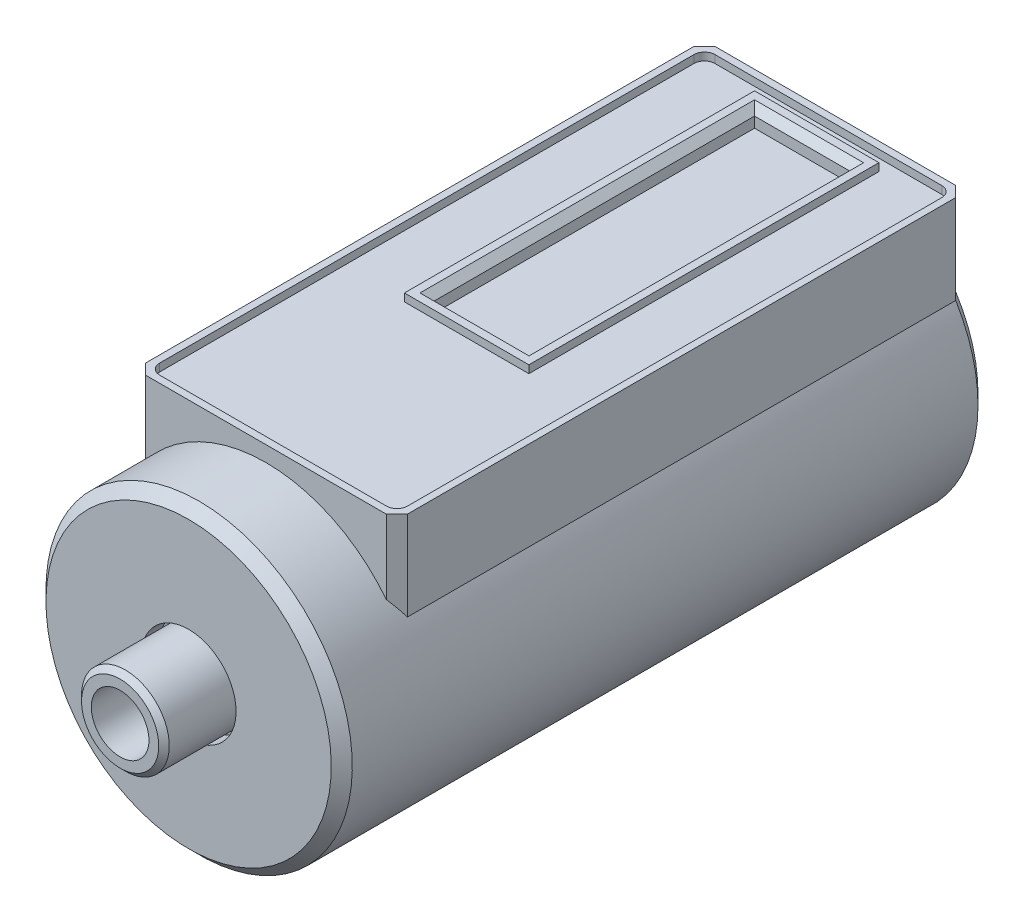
SolidWorks part; units mm, degrees
ref_plane "Front" through (0, 0, 0) normal (0, 0, 1) x (1, 0, 0)
ref_plane "Top" through (0, 0, 0) normal (0, 1, 0) x (1, 0, 0)
ref_plane "Right" through (0, 0, 0) normal (1, 0, 0) x (0, 0, -1)
sketch "Sketch2" plane through (0, 0, 0) normal (1, 0, 0) x (0, 0, -1)
  line L0 (4.31, 0) -> (4.31, 2.79)
  line L1 (4.69, 3.17) -> (10.53, 3.17)
  line L2 (9.26, 3.43) -> (9.26, 10.31)
  line L3 (10.02, 11.07) -> (56, 11.07)
  line L4 (56, 11.07) -> (56, 0)
  line L5 (56, 0) -> (4.31, 0)
  line L6 (9.26, 3.43) -> (10.53, 3.43)
  line L7 (10.53, 3.43) -> (10.53, 3.17)
  line L8 (4.31, 2.79) -> (4.69, 3.17)
  line L9 (9.26, 10.31) -> (10.02, 11.07)
  dimension "D1" = 51.69
  dimension "D2" = 3.17
  dimension "D3" = 11.07
  dimension "D4" = 4.95
  dimension "D5" = 1.27
  dimension "D6" = 3.43
  dimension "D7" = 2.79
  dimension "D8" = 0.38
  dimension "D9" = 0.76
  dimension "D10" = 10.31
  dimension "D11" = 56
revolve "Revolve1" add sketch "Sketch2" angle 360 about L5
sketch "Sketch3" plane through (0, 0, 0) normal (0, 1, 0) x (1, 0, 0)
  line L0 (11.07, 56) -> (-11.07, 56) construction
  line L1 (-9.46, 56) -> (9.46, 56)
  line L2 (-9.46, 56) -> (-9.46, 15.61)
  line L3 (-8.7, 14.85) -> (8.7, 14.85)
  line L4 (9.46, 56) -> (9.46, 15.61)
  line L5 (-9.46, 15.61) -> (-8.7, 14.85)
  line L6 (9.46, 15.61) -> (8.7, 14.85)
  point P1 (9.46, 14.85)
  point P2 (-9.46, 14.85)
  point P6 (0, 14.85)
  dimension "D1" = 41.15
  dimension "D2" = 18.92
extrude "Extrude1" add sketch "Sketch3" along normal blind 12.19
chamfer "Chamfer1" distance 0.76 angle 45 3 edges at (-9.46, 8.9696, -56) (0, -11.07, -56) (9.46, 8.9696, -56)
sketch "Sketch4" plane through (0, 12.19, 0) normal (0, 1, 0) x (1, 0, 0)
  line L0 (-8.7, 14.85) -> (8.7, 14.85) construction
  line L1 (-8.19, 55.49) -> (8.2, 55.49)
  line L2 (-8.95, 54.73) -> (-8.95, 16.12)
  line L3 (-8.19, 15.36) -> (8.2, 15.36)
  line L4 (8.96, 54.73) -> (8.96, 16.12)
  line L5 (-9.46, 15.61) -> (-9.46, 55.24) construction
  line L7 (-4.49, 54.65) -> (4.5, 54.65)
  line L8 (-4.49, 54.65) -> (-4.49, 29.35)
  line L9 (-4.49, 29.35) -> (4.5, 29.35)
  line L10 (4.5, 54.65) -> (4.5, 29.35)
  arc A0 (-8.95, 54.73) -> (-8.19, 55.49) centre (-8.19, 54.73) cw
  arc A1 (8.96, 54.73) -> (8.2, 55.49) centre (8.2, 54.73) ccw
  arc A2 (8.96, 16.12) -> (8.2, 15.36) centre (8.2, 16.12) cw
  arc A3 (-8.95, 16.12) -> (-8.19, 15.36) centre (-8.19, 16.12) ccw
  dimension "D5" = 0.76
  dimension "D1" = 17.91
  dimension "D2" = 40.13
  dimension "D3" = 0.51
  dimension "D4" = 0.51
  dimension "D6" = 0.84
  dimension "D7" = 4.46
  dimension "D8" = 4.46
  dimension "D9" = 25.3
extrude "Cut-Extrude1" cut sketch "Sketch4" against normal blind 0.56
sketch "Sketch5" plane through (0, 12.19, 0) normal (0, 1, 0) x (1, 0, 0)
  line L1 (-3.42, 53.58) -> (3.44, 53.58)
  line L2 (-3.42, 53.58) -> (-3.42, 30.42)
  line L3 (-3.42, 30.42) -> (3.44, 30.42)
  line L4 (3.44, 53.58) -> (3.44, 30.42)
  line L6 (4.5, 54.65) -> (-4.49, 54.65) construction
  line L7 (-4.49, 54.65) -> (-4.49, 29.35) construction
  point P4 (0.005, 54.65)
  dimension "D1" = 6.86
  dimension "D2" = 23.16
  dimension "D3" = 1.07
  dimension "D4" = 1.07
extrude "Cut-Extrude2" cut sketch "Sketch5" against normal blind 1.27
chamfer "Chamfer2" distance 0.51 angle 45 4 edges at (0.01, 12.19, -30.42) (3.44, 12.19, -42) (-3.42, 12.19, -42) (0.01, 12.19, -53.58)
hole_wizard "Hole1" positions "Sketch7" profile "Sketch6" legacy
sketch "Sketch7" plane through (0, 0, -4.31) normal (0, 0, 1) x (1, 0, 0)
  circle A0 centre (0, 0) radius 3.17 construction
  point P0 (0, 0)
sketch "Sketch6" plane through (0, 0, -4.31) normal (1, 0, 0) x (0, -1, 0)
  line L0 (0, 0) -> (0, 7.6015)
  line L1 (0, 7.6015) -> (2.0828, 6.35)
  line L2 (2.0828, 6.35) -> (2.0828, 0)
  line L4 (2.0828, 0) -> (0, 0)
  line L6 (0, 7.6015) -> (-2.0828, 6.35) construction
  line L7 (0, -4.2442) -> (0, 117.3081) construction
  dimension "Diameter" = 4.1656
  dimension "Depth" = 6.35
  dimension "Drill Angle" = 118
